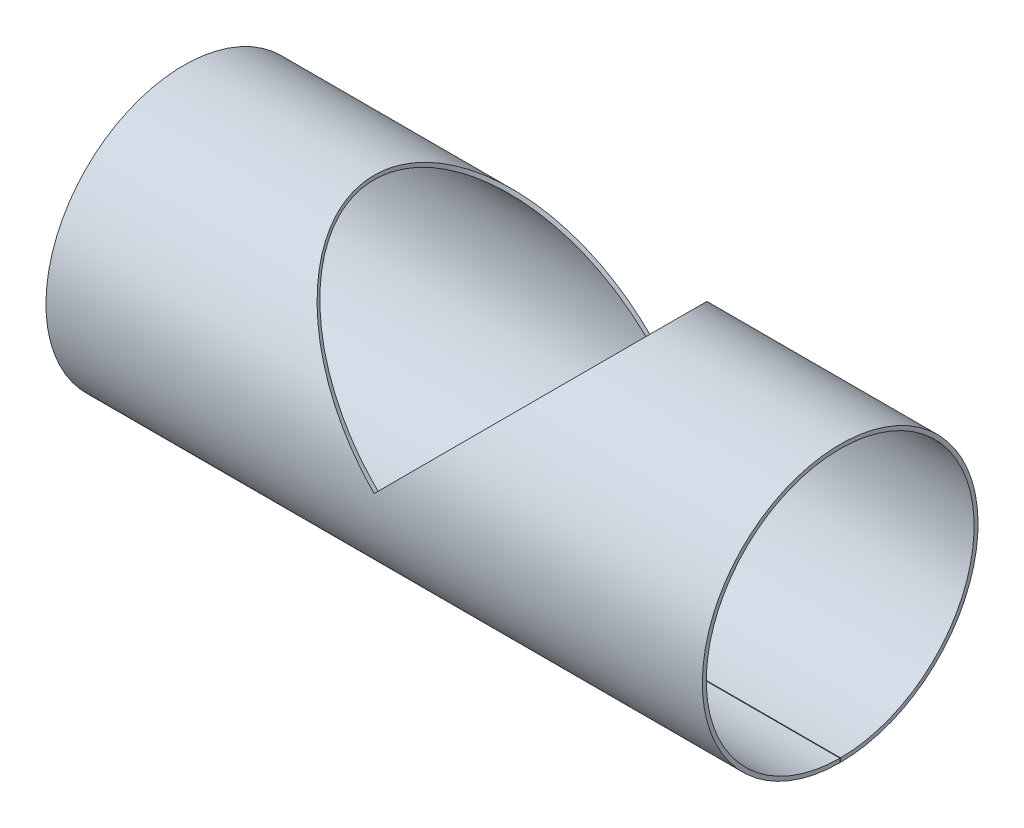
SolidWorks part; units mm, degrees
ref_plane "前视基准面" through (0, 0, 0) normal (0, 0, 1) x (1, 0, 0)
ref_plane "上视基准面" through (0, 0, 0) normal (0, 1, 0) x (1, 0, 0)
ref_plane "右视基准面" through (0, 0, 0) normal (1, 0, 0) x (0, 0, -1)
imported_body "基体零件-等径直交三通管-1"
sheet metal parameters "钣金1" parameters "D1"=0.7366, "厚度"=6
bend "圆角折弯1" bend radius 204 bend angle 359.727 parameters "D5"=1
flatten bends "展开-折弯1"
sketch "尖角-草图1" plane through (0, -209.9994, 0.5) normal (0, -1, 0.0024) x (1, 0, 0)
  line L0 (-500, 640.3992) -> (500, 640.3992) construction
  dimension "D1" = 0
process bends "加工-折弯1" parameters "D1"=0
sketch "平面-草图1" plane through (0, -209.9994, 0.5) normal (0, -1, 0.0024) x (1, 0, 0)
